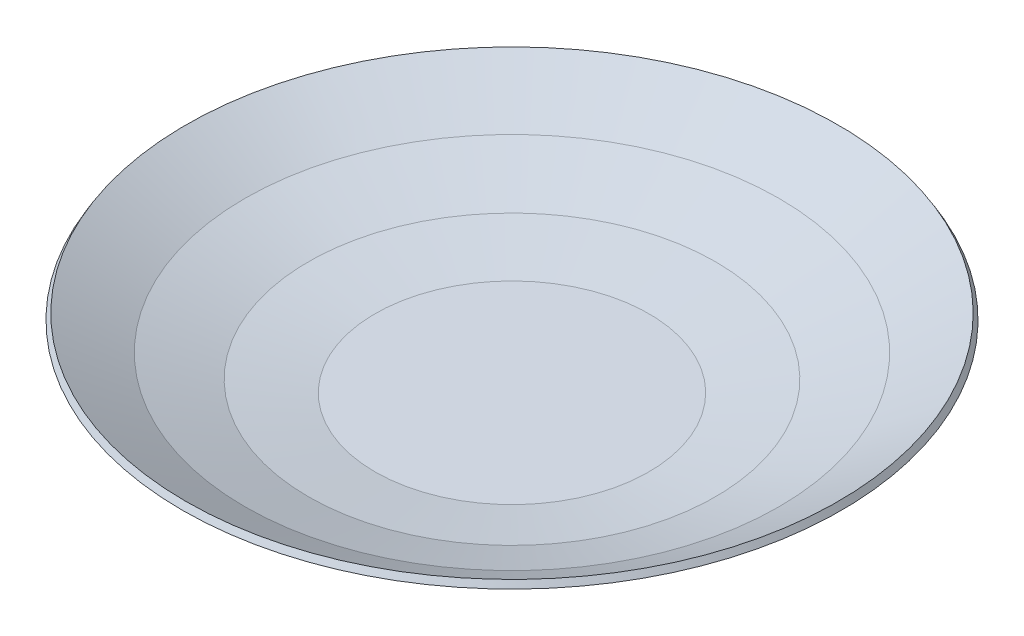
SolidWorks part; units mm, degrees
ref_plane "Front Plane" through (0, 0, 0) normal (0, 0, 1) x (1, 0, 0)
ref_plane "Top Plane" through (0, 0, 0) normal (0, 1, 0) x (1, 0, 0)
ref_plane "Right Plane" through (0, 0, 0) normal (1, 0, 0) x (0, 0, -1)
sketch "Sketch2" plane through (0, 0, 0) normal (0, 0, 1) x (1, 0, 0)
  line L0 (0, 0) -> (19.9125, 0)
  line L1 (20.0862, 0.0152) -> (29.7619, 1.7213)
  line L2 (29.9303, 1.7664) -> (39.1628, 5.1268)
  line L3 (39.3208, 5.2004) -> (47.9053, 10.1567)
  line L4 (0, 1) -> (19.9125, 1)
  line L5 (19.9125, 1) -> (29.5883, 2.7061)
  line L6 (29.5883, 2.7061) -> (38.8208, 6.0665)
  line L7 (38.8208, 6.0665) -> (47.4053, 11.0227)
  line L8 (47.4053, 11.0227) -> (47.9053, 10.1567)
  line L9 (0, 1) -> (0, 0)
  arc A0 (39.1628, 5.1268) -> (39.3208, 5.2004) centre (38.8208, 6.0665) ccw
  arc A1 (29.7619, 1.7213) -> (29.9303, 1.7664) centre (29.5883, 2.7061) ccw
  arc A2 (19.9125, 0) -> (20.0862, 0.0152) centre (19.9125, 1) ccw
  arc A3 (19.9125, 1) -> (19.9125, 1) centre (19.9125, 1) ccw
  arc A4 (29.5883, 2.7061) -> (29.5883, 2.7061) centre (29.5883, 2.7061) ccw
  arc A5 (38.8208, 6.0665) -> (38.8208, 6.0665) centre (38.8208, 6.0665) ccw
  point P8 (39.245, 5.1567)
  point P11 (29.8481, 1.7365)
  point P14 (20, 0)
  dimension "D4" = 10
  dimension "D5" = 170
  dimension "D8" = 1
  dimension "D1" = 20
  dimension "D2" = 10
  dimension "D3" = 10
  dimension "D6" = 170
  dimension "D7" = 170
  dimension "D9" = 1
revolve "Revolve1" add sketch "Sketch2" angle 360 about L9
